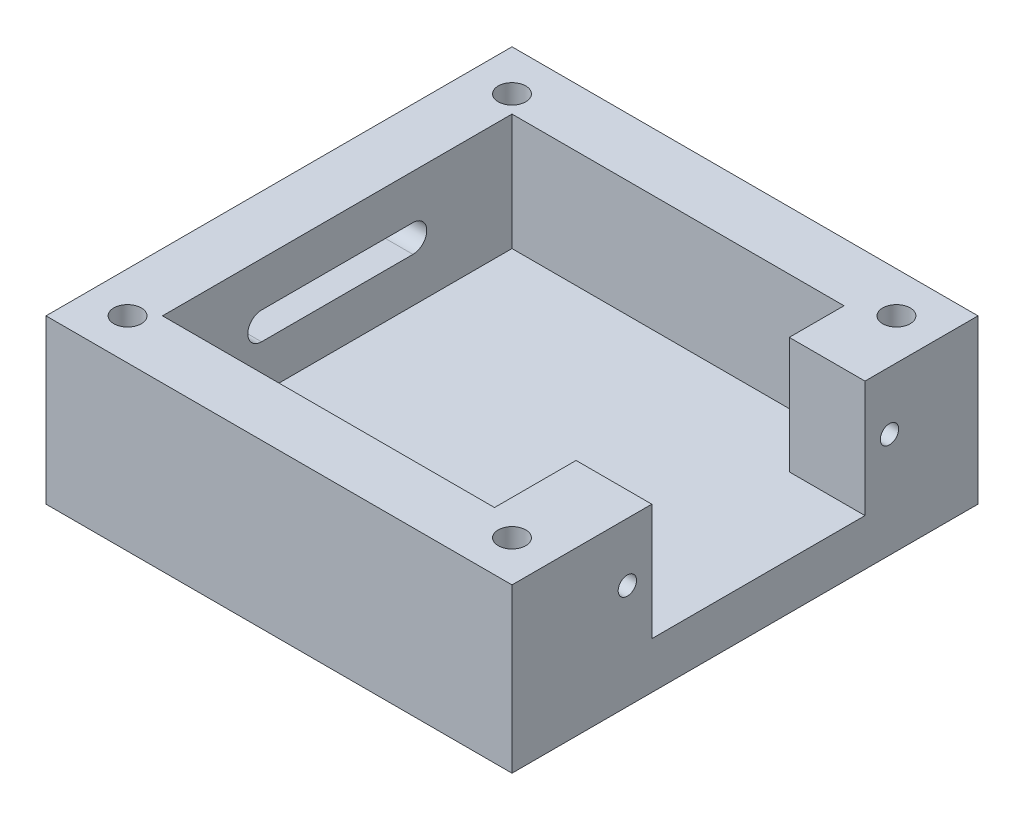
SolidWorks part; units mm, degrees
ref_plane "Front Plane" through (0, 0, 0) normal (0, 0, 1) x (1, 0, 0)
ref_plane "Top Plane" through (0, 0, 0) normal (0, 1, 0) x (1, 0, 0)
ref_plane "Right Plane" through (0, 0, 0) normal (1, 0, 0) x (0, 0, -1)
sketch "Sketch1" plane through (0, 0, 0) normal (0, 1, 0) x (1, 0, 0)
  line L1 (-25.4, -25.4) -> (25.4, -25.4)
  line L2 (-25.4, -25.4) -> (-25.4, 25.4)
  line L3 (-25.4, 25.4) -> (25.4, 25.4)
  line L4 (25.4, -25.4) -> (25.4, 25.4)
  line L5 (-25.4, -25.4) -> (25.4, 25.4) construction
  line L6 (-25.4, 25.4) -> (25.4, -25.4) construction
  point P0 (0, 0)
  dimension "D1" = 50.8
  dimension "D2" = 50.8
extrude "Boss-Extrude1" add sketch "Sketch1" along normal blind 5.08
sketch "Sketch2" plane through (0, 5.08, 0) normal (0, 1, 0) x (1, 0, 0)
  line L0 (-25.4, -25.4) -> (25.4, -25.4) construction
  line L1 (25.4, -25.4) -> (25.4, 25.4) construction
  line L2 (25.4, 25.4) -> (-25.4, 25.4) construction
  line L3 (-25.4, 25.4) -> (-25.4, -25.4) construction
  line L4 (-25.4, -25.4) -> (25.4, -25.4)
  line L5 (25.4, -25.4) -> (25.4, -10.16)
  line L6 (25.4, 25.4) -> (-25.4, 25.4)
  line L7 (-25.4, 25.4) -> (-25.4, -25.4)
  line L8 (-19.05, 19.05) -> (-19.05, -19.05)
  line L9 (-19.05, -19.05) -> (17.145, -19.05)
  line L11 (17.145, 19.05) -> (-19.05, 19.05)
  line L13 (17.145, -19.05) -> (17.145, -10.16)
  line L14 (17.145, 19.05) -> (17.145, 13.081)
  line L15 (17.145, 13.081) -> (25.4, 13.081)
  line L16 (17.145, -10.16) -> (25.4, -10.16)
  line L17 (25.4, 13.081) -> (25.4, 25.4)
  dimension "D2" = 15.24
  dimension "D3" = 23.241
  dimension "D1" = 8.255
  dimension "D4" = 6.35
  dimension "D5" = 6.35
  dimension "D6" = 6.35
extrude "Boss-Extrude2" add sketch "Sketch2" along normal blind 12.7
sketch "Sketch3" plane through (17.145, 0, 0) normal (-1, 0, 0) x (0, 0, 1)
  line L0 (10.16, 17.78) -> (10.16, 5.08) construction
  line L1 (10.16, 5.08) -> (19.05, 5.08) construction
  line L2 (-19.05, 5.08) -> (-13.081, 5.08) construction
  line L4 (-13.081, 17.78) -> (-13.081, 5.08) construction
  circle A0 centre (12.827, 11.43) radius 1
  circle A1 centre (-15.748, 11.43) radius 1
  dimension "D2" = 2
  dimension "D1" = 2.667
  dimension "D3" = 6.35
  dimension "D4" = 6.35
  dimension "D5" = 2.667
extrude "Cut-Extrude1" cut sketch "Sketch3" against normal through all
sketch "Sketch5" plane through (0, 0, 0) normal (0, -1, 0) x (1, 0, 0)
  line L1 (-20.955, -20.955) -> (20.955, -20.955) construction
  line L2 (-20.955, -20.955) -> (-20.955, 20.955) construction
  line L3 (-20.955, 20.955) -> (20.955, 20.955) construction
  line L4 (20.955, -20.955) -> (20.955, 20.955) construction
  line L5 (-20.955, -20.955) -> (20.955, 20.955) construction
  line L6 (-20.955, 20.955) -> (20.955, -20.955) construction
  circle A0 centre (-20.955, 20.955) radius 2.921
  circle A1 centre (-20.955, -20.955) radius 2.921
  circle A2 centre (20.955, -20.955) radius 2.921
  circle A3 centre (20.955, 20.955) radius 2.921
  point P0 (0, 0)
  dimension "D3" = 5.842
  dimension "D1" = 41.91
  dimension "D2" = 41.91
extrude "Cut-Extrude2" cut sketch "Sketch5" against normal blind 4.445
sketch "Sketch6" plane through (0, 4.445, 0) normal (0, -1, 0) x (1, 0, 0)
  circle A0 centre (-20.955, 20.955) radius 1.4999
  circle A1 centre (20.955, 20.955) radius 1.4999
  circle A2 centre (20.955, -20.955) radius 1.4999
  circle A3 centre (-20.955, -20.955) radius 1.4999
  dimension "D1" = 2.9997
extrude "Cut-Extrude3" cut sketch "Sketch6" against normal through all
sketch "Sketch8" plane through (0, 0, 0) normal (0, -1, 0) x (1, 0, 0)
  circle A0 centre (0, 0) radius 4.064
  point P2 (0, 0)
  dimension "D1" = 8.128
extrude "Cut-Extrude5" cut sketch "Sketch8" against normal blind 2.54
sketch "Sketch9" plane through (-25.4, 0, 0) normal (-1, 0, 0) x (0, 0, 1)
  line L0 (8.255, 11.43) -> (-8.255, 11.43) construction
  line L1 (8.255, 9.93) -> (-8.255, 9.93)
  line L2 (8.255, 12.93) -> (-8.255, 12.93)
  arc A0 (8.255, 9.93) -> (8.255, 12.93) centre (8.255, 11.43) ccw
  arc A1 (-8.255, 12.93) -> (-8.255, 9.93) centre (-8.255, 11.43) ccw
  point P2 (0, 11.43)
  dimension "D1" = 3
  dimension "D2" = 16.51
  dimension "D3" = 11.43
extrude "Cut-Extrude6" cut sketch "Sketch9" against normal up to next
